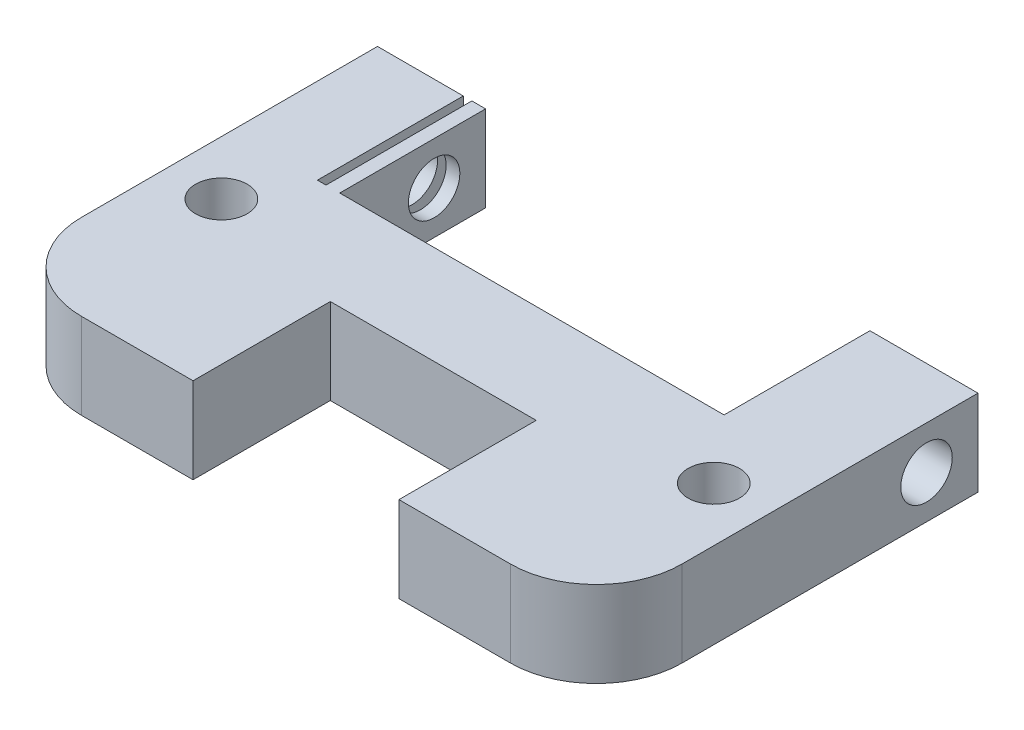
SolidWorks part; units mm, degrees
ref_plane "Ebene vorne" through (0, 0, 0) normal (0, 0, 1) x (1, 0, 0)
ref_plane "Ebene oben" through (0, 0, 0) normal (0, 1, 0) x (1, 0, 0)
ref_plane "Ebene rechts" through (0, 0, 0) normal (1, 0, 0) x (0, 0, -1)
sketch "Skizze1" plane through (0, 0, 0) normal (0, 1, 0) x (1, 0, 0)
  line L0 (0, 48.5029) -> (0, -41.1937) construction
  line L1 (11.2, 0) -> (17.5, 0)
  line L2 (-17.5, 0) -> (-12.5, 0)
  line L3 (-17.5, 0) -> (-17.5, -22.25)
  line L4 (-17.5, -22.25) -> (-6, -22.25)
  line L5 (17.5, 0) -> (17.5, -22.25)
  line L6 (14.35, 0) -> (14.35, -22.25) construction
  line L7 (-11.2, 0) -> (-11.2, -8.5)
  line L8 (-11.2, -8.5) -> (11.2, -8.5)
  line L9 (11.2, 0) -> (11.2, -8.5)
  line L10 (17.5, -12.25) -> (-17.5, -12.25) construction
  line L11 (-12, 0) -> (-12, -8.5)
  line L12 (-12, -8.5) -> (-12.5, -8.5)
  line L13 (-12.5, -8.5) -> (-12.5, 0)
  line L14 (-12, 0) -> (-11.2, 0)
  line L15 (6, -22.25) -> (17.5, -22.25)
  line L17 (-6, -22.25) -> (-6, -14.25)
  line L18 (-6, -14.25) -> (6, -14.25)
  line L19 (6, -22.25) -> (6, -14.25)
  circle A0 centre (14.35, -12.25) radius 1.5
  circle A1 centre (-14.35, -12.25) radius 1.5
  dimension "D5" = 3
  dimension "D1" = 35
  dimension "D2" = 22.4
  dimension "D3" = 8.5
  dimension "D4" = 3.75
  dimension "D6" = 12
  dimension "D7" = 0.5
  dimension "D8" = 0.8
  dimension "D9" = 8
  dimension "D10" = 10
extrude "Aufsatz-Linear austragen4" add sketch "Skizze1" along normal blind 5
sketch "Skizze3" plane through (17.5, 0, 0) normal (1, 0, 0) x (0, 0, -1)
  line L0 (-3, 5) -> (-3, 0) construction
  line L1 (-22.25, 5) -> (0, 5) construction
  line L2 (-22.25, 0) -> (0, 0) construction
  line L3 (0, 5) -> (0, 0) construction
  circle A0 centre (-3, 2.5) radius 1.5
  dimension "D2" = 3
  dimension "D1" = 3
extrude "Schnitt-Linear austragen2" cut sketch "Skizze3" against normal through all
fillet "Verrundung1" radius 5 2 edges at (-17.5, 2.5, 22.25) (17.5, 2.5, 22.25)
